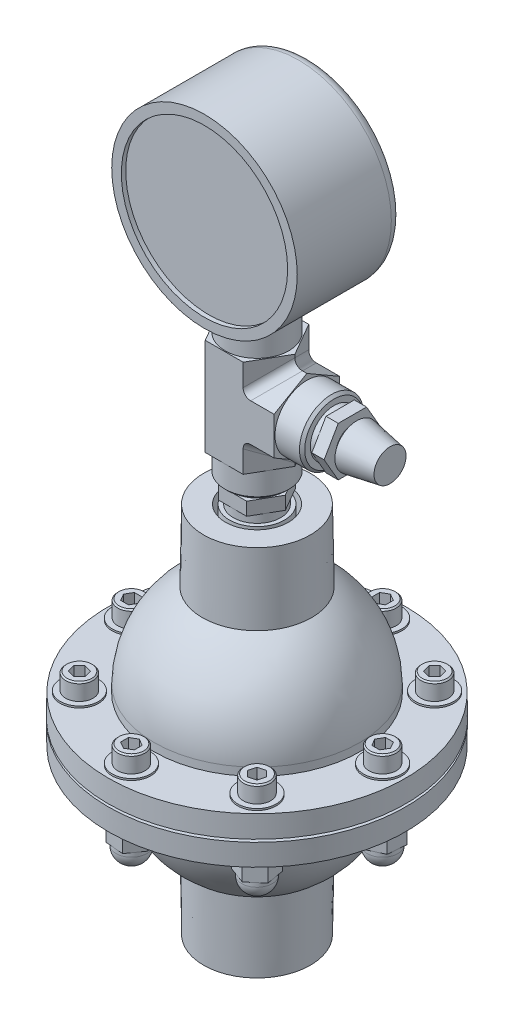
SolidWorks part; units mm, degrees
ref_plane "Front Plane" through (0, 0, 0) normal (0, 0, 1) x (1, 0, 0)
ref_plane "Top Plane" through (0, 0, 0) normal (0, 1, 0) x (1, 0, 0)
ref_plane "Right Plane" through (0, 0, 0) normal (1, 0, 0) x (0, 0, -1)
sketch "Sketch1" plane through (0, 0, 0) normal (0, 1, 0) x (1, 0, 0)
  circle A0 centre (0, 0) radius 43.2435
  dimension "D1" = 86.487
extrude "Extrude1" add sketch "Sketch1" along normal blind 6.35 draft 1
sketch "Sketch2" plane through (0, 0, 0) normal (0, 1, 0) x (1, 0, 0)
  circle A0 centre (0, 0) radius 29.972
  dimension "D1" = 59.944
extrude "Extrude2" add sketch "Sketch2" along normal blind 37.338 draft 1
fillet "Fillet1" radius 29.21 1 edges at (0, 37.338, 29.3203)
ref_plane "Plane1" through (0, 53.6702, 0) normal (0, 1, 0) x (-1, 0, 0)
sketch "Sketch3" plane through (0, 53.6702, 0) normal (0, 1, 0) x (-1, 0, 0)
  circle A0 centre (0, 0) radius 15.494
  dimension "D1" = 30.988
extrude "Extrude3" add sketch "Sketch3" against normal up to surface (53.6702 mm away) draft 1
sketch "Sketch4" plane through (0, 53.6702, 0) normal (0, 1, 0) x (-1, 0, 0)
  circle A0 centre (0, 0) radius 9.144
  circle A1 centre (0, 0) radius 8.001
  dimension "D1" = 18.288
  dimension "D2" = 1.143
extrude "Extrude4" cut sketch "Sketch4" against normal blind 16.637 draft 1
hole_wizard "1/4 NPT Tapped Hole1" positions "Sketch6" profile "Sketch5" size "1/4" standard "Ansi Inch"
sketch "Sketch6" plane through (0, 53.6702, 0) normal (0, 1, 0) x (-1, 0, 0)
  point P0 (0, 0)
sketch "Sketch5" plane through (0, 53.6702, 0) normal (1, 0, 0) x (0, 0, 1)
  line L0 (0, 0) -> (0, 20.3603)
  line L1 (5.5626, 17.018) -> (0, 20.3603)
  line L2 (-5.5626, 17.018) -> (0, 20.3603) construction
  line L3 (5.5626, 17.018) -> (5.5626, 9.906)
  line L4 (5.5626, 9.906) -> (6.558, 9.906)
  line L5 (6.558, 9.906) -> (6.8546, 0)
  line L6 (-6.558, 9.906) -> (-6.8546, 0) construction
  line L7 (6.8546, 0) -> (0, 0)
  line L8 (0, -6.35) -> (0, 107.95) construction
  line L11 (-5.5626, 9.906) -> (-6.558, 9.906) construction
  dimension "Tap Drill Dia." = 11.1252
  dimension "Tap Drill Depth" = 17.018
  dimension "Thread Dia." = 13.7092
  dimension "Thread Angle" = 3.43
  dimension "Thread Depth" = 9.906
  dimension "Drill Angle" = 118
ref_plane "Plane2" through (0, -0.762, 0) normal (0, 1, 0) x (-1, 0, 0)
sketch "Sketch7" plane through (0, -0.762, 0) normal (0, 1, 0) x (-1, 0, 0)
  circle A0 centre (0, 0) radius 43.2435
  dimension "D1" = 86.487
extrude "Extrude5" add sketch "Sketch7" against normal blind 6.35 draft 1
sketch "Sketch8" plane through (0, -0.762, 0) normal (0, 1, 0) x (-1, 0, 0)
  circle A0 centre (0, 0) radius 32.4866
  dimension "D1" = 64.9732
extrude "Extrude6" add sketch "Sketch8" along normal blind 6.35
sketch "Sketch9" plane through (0, -0.762, 0) normal (0, 1, 0) x (-1, 0, 0)
  circle A0 centre (0, 0) radius 29.972
  dimension "D1" = 59.944
extrude "Extrude7" add sketch "Sketch9" against normal blind 37.338 draft 1
fillet "Fillet2" radius 29.21 1 edges at (0, -38.1, 29.3203)
ref_plane "Plane3" through (0, -54.483, 0) normal (0, 1, 0) x (-1, 0, 0)
sketch "Sketch11" plane through (0, -54.483, 0) normal (0, 1, 0) x (-1, 0, 0)
  circle A0 centre (0, 0) radius 15.494
  dimension "D1" = 30.988
extrude "Extrude8" add sketch "Sketch11" along normal up to surface (60.833 mm away) draft 1
hole_wizard "1/2 NPT Tapped Hole1" positions "Sketch13" profile "Sketch12" size "1/2" standard "Ansi Inch"
sketch "Sketch13" plane through (0, -54.483, 0) normal (0, 1, 0) x (-1, 0, 0)
  point P0 (0, 0)
sketch "Sketch12" plane through (0, -54.483, 0) normal (1, 0, 0) x (0, 0, -1)
  line L0 (0, 0) -> (0, 27.9705)
  line L1 (8.9281, 22.606) -> (0, 27.9705)
  line L2 (-8.9281, 22.606) -> (0, 27.9705) construction
  line L3 (8.9281, 22.606) -> (8.9281, 13.462)
  line L4 (8.9281, 13.462) -> (10.2617, 13.462)
  line L5 (10.2617, 13.462) -> (10.6647, 0)
  line L6 (-10.2617, 13.462) -> (-10.6647, 0) construction
  line L7 (10.6647, 0) -> (0, 0)
  line L8 (0, -6.35) -> (0, 107.95) construction
  line L11 (-8.9281, 13.462) -> (-10.2617, 13.462) construction
  dimension "Tap Drill Dia." = 17.8562
  dimension "Tap Drill Depth" = 22.606
  dimension "Thread Dia." = 21.3295
  dimension "Thread Angle" = 3.43
  dimension "Thread Depth" = 13.462
  dimension "Drill Angle" = 118
ref_plane "Plane4" through (0, 6.35, 0) normal (0, 1, 0) x (-1, 0, 0)
sketch "Sketch14" plane through (0, 6.35, 0) normal (0, 1, 0) x (-1, 0, 0)
  line L0 (0, 0) -> (-43.1327, 0) construction
  circle A0 centre (0, 0) radius 43.1327 construction
  circle A1 centre (0, 0) radius 36.449 construction
  circle A2 centre (-36.449, 0) radius 5.5626
  dimension "D1" = 72.898
  dimension "D2" = 11.1252
extrude "Extrude9" add sketch "Sketch14" along normal blind 0.508
ref_plane "Plane5" through (0, -7.112, 0) normal (0, 1, 0) x (-1, 0, 0)
sketch "Sketch15" plane through (0, -7.112, 0) normal (0, 1, 0) x (-1, 0, 0)
  line L0 (0, 0) -> (-43.1327, 0) construction
  circle A0 centre (0, 0) radius 43.1327 construction
  circle A1 centre (0, 0) radius 36.449 construction
  circle A2 centre (-36.449, 0) radius 5.5626
  dimension "D1" = 11.1252
extrude "Extrude10" add sketch "Sketch15" against normal blind 0.508
sketch "Sketch16" plane through (0, 6.35, 0) normal (0, 1, 0) x (-1, 0, 0)
  circle A0 centre (-36.449, 0) radius 3.9624
  dimension "D1" = 7.9248
extrude "Extrude11" add sketch "Sketch16" along normal blind 5.334
ref_plane "Plane6" through (0, 11.938, 0) normal (0, 1, 0) x (-1, 0, 0)
sketch "Sketch17" plane through (0, 11.938, 0) normal (0, 1, 0) x (-1, 0, 0)
  line L1 (-38.7367, 0) -> (-37.5928, -1.9812)
  line L2 (-37.5928, -1.9812) -> (-35.3052, -1.9812)
  line L3 (-35.3052, -1.9812) -> (-34.1613, 0)
  line L4 (-34.1613, 0) -> (-35.3052, 1.9812)
  line L5 (-35.3052, 1.9812) -> (-37.5928, 1.9812)
  line L6 (-37.5928, 1.9812) -> (-38.7367, 0)
  circle A0 centre (-36.449, 0) radius 1.9812 construction
extrude "Extrude12" cut sketch "Sketch17" against normal blind 3.175
chamfer "Chamfer1" distance 0.381 angle 45 1 edges at (36.449, 11.684, 3.9624)
sketch "Sketch18" plane through (0, -7.112, 0) normal (0, 1, 0) x (-1, 0, 0)
  line L1 (-40.7742, 3.0271) -> (-41.2332, -2.2322)
  line L2 (-41.2332, -2.2322) -> (-36.908, -5.2593)
  line L3 (-36.908, -5.2593) -> (-32.1238, -3.0271)
  line L4 (-32.1238, -3.0271) -> (-31.6648, 2.2322)
  line L5 (-31.6648, 2.2322) -> (-35.99, 5.2593)
  line L6 (-35.99, 5.2593) -> (-40.7742, 3.0271)
  circle A0 centre (-36.449, 0) radius 4.572 construction
extrude "Extrude13" add sketch "Sketch18" against normal blind 5.334
sketch "Sketch19" plane through (0, -7.112, 0) normal (0, 1, 0) x (-1, 0, 0)
  circle A0 centre (-36.449, 0) radius 4.445
  dimension "D1" = 8.89
extrude "Extrude14" add sketch "Sketch19" against normal blind 10.922
fillet "Fillet3" radius 4.318 1 edges at (36.449, -18.034, 4.445)
pattern_circular "CirPattern1" count 8 over 360 about axis through (0, 0, 0) along (0, 1, 0) of "Extrude9", "Extrude10", "Extrude11", "Extrude12", "Chamfer1", "Extrude13", "Extrude14", "Fillet3"
sketch "Sketch20" plane through (0, 0, 0) normal (0, 1, 0) x (1, 0, 0)
  circle A0 centre (0, 0) radius 6.858
  dimension "D1" = 13.716
extrude "Boss-Extrude1" add sketch "Sketch20" along normal blind 132.334
sketch "Sketch21" plane through (0, 0, 0) normal (0, 0, 1) x (1, 0, 0)
  line L0 (6.858, 132.334) -> (-6.858, 132.334) construction
  circle A0 centre (0, 132.334) radius 26.924
  dimension "D1" = 53.848
extrude "Boss-Extrude2" add sketch "Sketch21" along normal mid plane 30.48
ref_plane "Plane7" through (0, 56.2102, 0) normal (0, 1, 0) x (1, 0, 0)
ref_plane "Plane8" through (0, 61.2902, 0) normal (0, 1, 0) x (1, 0, 0)
sketch "Sketch23" plane through (0, 56.2102, 0) normal (0, 1, 0) x (1, 0, 0)
  line L1 (-8.2122, 0) -> (-4.1061, -7.112)
  line L2 (-4.1061, -7.112) -> (4.1061, -7.112)
  line L3 (4.1061, -7.112) -> (8.2122, 0)
  line L4 (8.2122, 0) -> (4.1061, 7.112)
  line L5 (4.1061, 7.112) -> (-4.1061, 7.112)
  line L6 (-4.1061, 7.112) -> (-8.2122, 0)
  circle A0 centre (0, 0) radius 7.112 construction
extrude "Boss-Extrude3" add sketch "Sketch23" along normal blind 3.81
sketch "Sketch24" plane through (0, 61.2902, 0) normal (0, 1, 0) x (1, 0, 0)
  circle A0 centre (0, 0) radius 9.271
  dimension "D1" = 18.542
extrude "Boss-Extrude4" add sketch "Sketch24" along normal blind 43.18
ref_plane "Plane9" through (0, 68.6562, 0) normal (0, 1, 0) x (1, 0, 0)
sketch "Sketch25" plane through (0, 68.6562, 0) normal (0, 1, 0) x (1, 0, 0)
  line L1 (-10.9985, 0) -> (-5.4993, -9.525)
  line L2 (-5.4993, -9.525) -> (5.4993, -9.525)
  line L3 (5.4993, -9.525) -> (10.9985, 0)
  line L4 (10.9985, 0) -> (5.4993, 9.525)
  line L5 (5.4993, 9.525) -> (-5.4993, 9.525)
  line L6 (-5.4993, 9.525) -> (-10.9985, 0)
  circle A0 centre (0, 0) radius 9.525 construction
extrude "Boss-Extrude5" add sketch "Sketch25" along normal blind 28.194
ref_plane "Plane10" through (14.478, 0, 0) normal (1, 0, 0) x (0, 0, -1)
ref_plane "Plane11" through (22.352, 0, 0) normal (1, 0, 0) x (0, 0, -1)
sketch "Sketch26" plane through (22.352, 0, 0) normal (1, 0, 0) x (0, 0, -1)
  line L0 (0, 96.8502) -> (0, 68.6562) construction
  circle A0 centre (0, 82.7532) radius 9.271
  dimension "D1" = 18.542
extrude "Boss-Extrude6" add sketch "Sketch26" against normal blind 22.098
sketch "Sketch27" plane through (14.478, 0, 0) normal (1, 0, 0) x (0, 0, -1)
  line L0 (0, 96.8502) -> (0, 68.6562) construction
  line L1 (0, 93.7517) -> (-9.525, 88.2525)
  line L2 (-9.525, 88.2525) -> (-9.525, 77.2539)
  line L3 (-9.525, 77.2539) -> (0, 71.7547)
  line L4 (0, 71.7547) -> (9.525, 77.2539)
  line L5 (9.525, 77.2539) -> (9.525, 88.2525)
  line L6 (9.525, 88.2525) -> (0, 93.7517)
  circle A0 centre (0, 82.7532) radius 9.525 construction
extrude "Boss-Extrude7" add sketch "Sketch27" against normal blind 14.224
ref_plane "Plane12" through (27.686, 0, 0) normal (1, 0, 0) x (0, 0, -1)
sketch "Sketch28" plane through (27.686, 0, 0) normal (1, 0, 0) x (0, 0, -1)
  line L0 (0, 96.8502) -> (0, 68.6562) construction
  circle A0 centre (0, 82.7532) radius 6.858
  dimension "D1" = 13.716
extrude "Boss-Extrude8" add sketch "Sketch28" against normal blind 14.224
sketch "Sketch29" plane through (27.686, 0, 0) normal (1, 0, 0) x (0, 0, -1)
  line L0 (0, 96.8502) -> (0, 68.6562) construction
  line L1 (-8.2122, 82.7532) -> (-4.1061, 75.6412)
  line L2 (-4.1061, 75.6412) -> (4.1061, 75.6412)
  line L3 (4.1061, 75.6412) -> (8.2122, 82.7532)
  line L4 (8.2122, 82.7532) -> (4.1061, 89.8652)
  line L5 (4.1061, 89.8652) -> (-4.1061, 89.8652)
  line L6 (-4.1061, 89.8652) -> (-8.2122, 82.7532)
  circle A0 centre (0, 82.7532) radius 7.112 construction
extrude "Boss-Extrude9" add sketch "Sketch29" against normal blind 3.556
ref_plane "Plane13" through (28.956, 0, 0) normal (1, 0, 0) x (0, 0, -1)
sketch "Sketch30" plane through (28.956, 0, 0) normal (1, 0, 0) x (0, 0, -1)
  line L0 (0, 96.8502) -> (0, 68.6562) construction
  circle A0 centre (0, 82.7532) radius 4.7625
  dimension "D1" = 9.525
extrude "Boss-Extrude10" add sketch "Sketch30" against normal blind 3.556
sketch "Sketch31" plane through (28.956, 0, 0) normal (1, 0, 0) x (0, 0, -1)
  line L0 (0, 96.8502) -> (0, 68.6562) construction
  circle A0 centre (0, 82.7532) radius 6.35
  dimension "D1" = 12.7
extrude "Boss-Extrude11" add sketch "Sketch31" along normal blind 9.652 draft 10
fillet "Fillet4" radius 2.54 4 edges at (8.2489, 74.5043, -4.7625) (8.2489, 74.5043, 4.7625) (8.2489, 91.0021, -4.7625) (8.2489, 91.0021, 4.7625)
chamfer "Chamfer2" distance 0.762 angle 45 3 edges at (0, 61.2902, 9.271) (22.352, 82.7532, -9.271) (0, 104.4702, 9.271)
fillet "Fillet5" radius 3.175 1 edges at (26.924, 132.334, -15.24)
ref_plane "Plane14" through (0, 0, 15.24) normal (0, 0, 1) x (1, 0, 0)
sketch "Sketch32" plane through (0, 0, 15.24) normal (0, 0, 1) x (1, 0, 0)
  circle A0 centre (0, 132.334) radius 24.13
  dimension "D1" = 48.26
extrude "Cut-Extrude1" cut sketch "Sketch32" against normal blind 1.27
